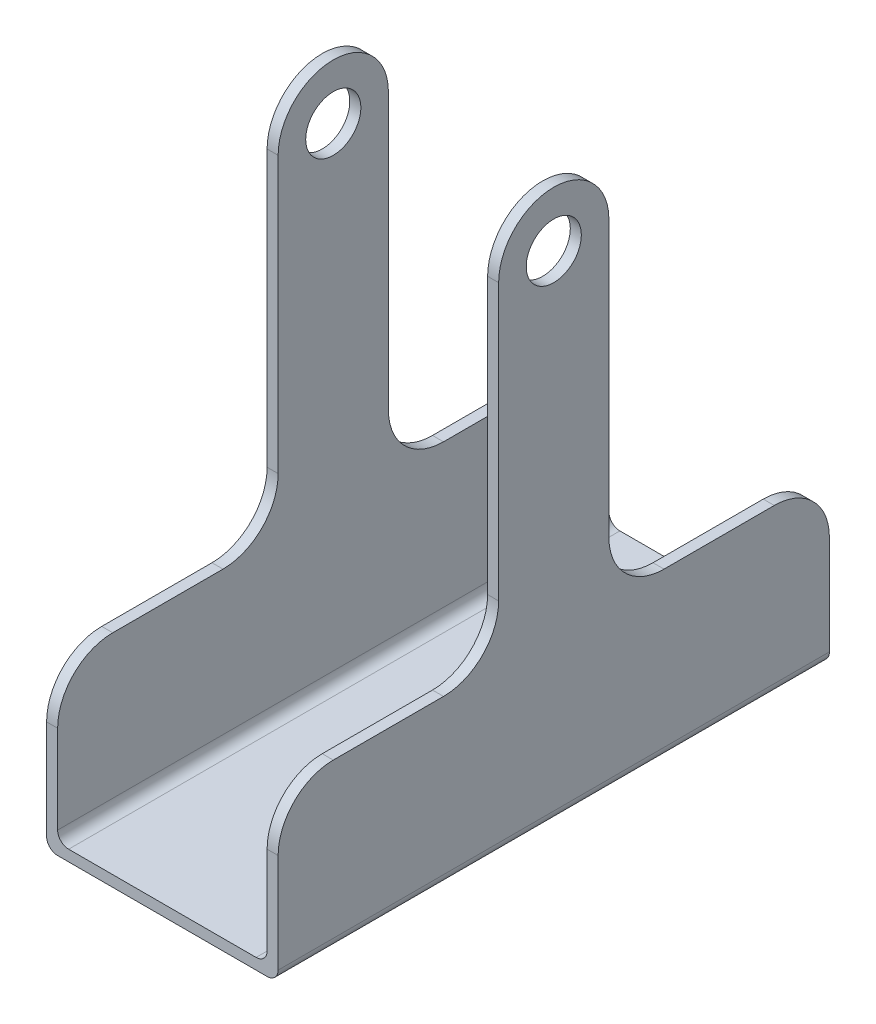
SolidWorks part; units mm, degrees
ref_plane "Front" through (0, 0, 0) normal (0, 0, 1) x (1, 0, 0)
ref_plane "Top" through (0, 0, 0) normal (0, 1, 0) x (1, 0, 0)
ref_plane "Right" through (0, 0, 0) normal (1, 0, 0) x (0, 0, -1)
sketch "Sketch1" plane through (0, 0, 0) normal (0, 1, 0) x (1, 0, 0)
  line L1 (0, 0) -> (19, 0)
  line L2 (0, 0) -> (0, 50)
  line L3 (0, 50) -> (19, 50)
  line L4 (19, 0) -> (19, 50)
extrude "Extrude1" add sketch "Sketch1" along normal blind 1
sketch "Sketch3" plane through (19, 0, 0) normal (1, 0, 0) x (0, 0, -1)
  line L1 (0, 0) -> (50, 0)
  line L2 (0, 0) -> (0, 50)
  line L3 (0, 50) -> (50, 50)
  line L4 (50, 0) -> (50, 50)
  circle A0 centre (25, 45) radius 2.5
extrude "Extrude2" add sketch "Sketch3" along normal blind 1
sketch "Sketch4" plane through (0, 0, 0) normal (-1, 0, 0) x (0, 0, 1)
  line L1 (0, 0) -> (-50, 0)
  line L2 (0, 0) -> (0, 50)
  line L3 (0, 50) -> (-50, 50)
  line L4 (-50, 0) -> (-50, 50)
  circle A0 centre (-25, 45) radius 2.5
extrude "Extrude3" add sketch "Sketch4" along normal blind 1
sketch "Sketch5" plane through (-1, 0, 0) normal (-1, 0, 0) x (0, 0, 1)
  line L0 (-30, 45) -> (-30, 20)
  line L1 (-35, 15) -> (-45, 15)
  line L2 (-50, 10) -> (-63.7817, 10)
  line L3 (-50, 50) -> (-50, 0) construction
  line L6 (-15, 15) -> (-5, 15)
  line L7 (-20, 45) -> (-20, 20)
  line L8 (-63.7817, 10) -> (-63.7817, 64.0357)
  line L9 (-63.7817, 64.0357) -> (11.6705, 64.0357)
  line L10 (11.6705, 64.0357) -> (11.6705, 10)
  line L11 (11.6705, 10) -> (0, 10)
  arc A0 (-20, 45) -> (-30, 45) centre (-25, 45) ccw
  arc A1 (-35, 15) -> (-30, 20) centre (-35, 20) ccw
  arc A2 (-50, 10) -> (-45, 15) centre (-45, 10) cw
  arc A3 (0, 10) -> (-5, 15) centre (-5, 10) ccw
  arc A4 (-15, 15) -> (-20, 20) centre (-15, 20) cw
  point P13 (-30, 15)
  point P15 (-50, 15)
  point P25 (0, 15)
  point P26 (-20, 15)
extrude "Cut-Extrude1" cut sketch "Sketch5" against normal through all
fillet "Fillet1" radius 1 1 edges
fillet "Fillet2" radius 1 1 edges
fillet "Fillet3" radius 1 2 edges at (20, 0, -25) (-1, 0, -25)
